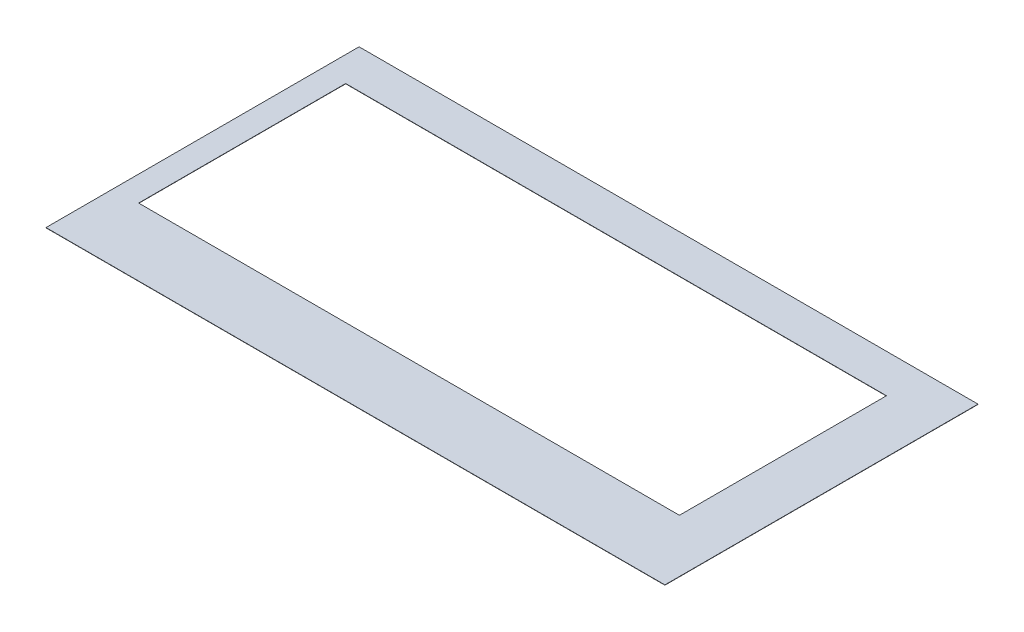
SolidWorks part; units mm, degrees
ref_plane "Front Plane" through (0, 0, 0) normal (0, 0, 1) x (1, 0, 0)
ref_plane "Top Plane" through (0, 0, 0) normal (0, 1, 0) x (1, 0, 0)
ref_plane "Right Plane" through (0, 0, 0) normal (1, 0, 0) x (0, 0, -1)
sketch "Sketch1" plane through (0, 0, 0) normal (0, 1, 0) x (1, 0, 0)
  line L0 (-1.4, 56.1) -> (-1.4, 0) construction
  line L1 (0, 0) -> (109.5, 0)
  line L3 (0, 56.1) -> (109.5, 56.1)
  line L4 (109.5, 0) -> (109.5, 56.1)
  line L5 (3.1, 12.1) -> (100, 12.1)
  line L6 (3.1, 12.1) -> (3.1, 49.2)
  line L7 (3.1, 49.2) -> (100, 49.2)
  line L8 (100, 12.1) -> (100, 49.2)
  line L9 (-1.4, 56.1) -> (-1.4, 0)
  line L10 (0, 0) -> (-1.4, 0)
  line L11 (-1.4, 56.1) -> (0, 56.1)
  dimension "D1" = 56.1
  dimension "D2" = 109.5
  dimension "D3" = 37.1
  dimension "D4" = 96.9
  dimension "D5" = 4.5
  dimension "D6" = 12.1
  dimension "D7" = 6.9
extrude "Boss-Extrude1" add sketch "Sketch1" along normal blind 0.05
